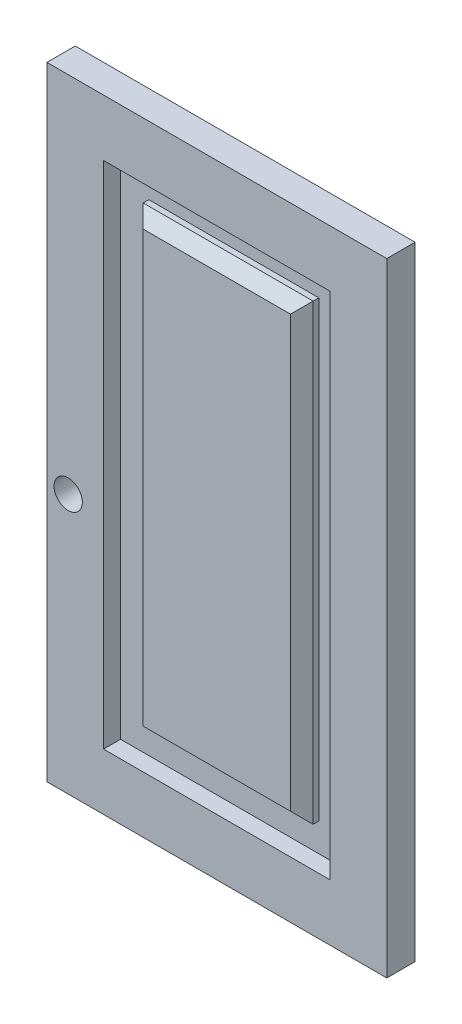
SolidWorks part; units mm, degrees
ref_plane "Front" through (0, 0, 0) normal (0, 0, 1) x (1, 0, 0)
ref_plane "Top" through (0, 0, 0) normal (0, 1, 0) x (1, 0, 0)
ref_plane "Right" through (0, 0, 0) normal (1, 0, 0) x (0, 0, -1)
sketch "Sketch1" plane through (0, 0, 0) normal (0, 0, 1) x (1, 0, 0)
  line L1 (0, 0) -> (60, 0)
  line L2 (0, 0) -> (0, 110)
  line L3 (0, 110) -> (60, 110)
  line L4 (60, 0) -> (60, 110)
extrude "Base-Extrude" add sketch "Sketch1" against normal blind 5
sketch "Sketch2" plane through (-46.244, -4.1497, 0) normal (0, 0, 1) x (1, 0, 0)
  circle A0 centre (50, 50) radius 2.5
  dimension "D1" = 5
extrude "Cut-Extrude1" cut sketch "Sketch2" against normal blind 5
sketch "Sketch3" plane through (0, 0, 0) normal (0, 0, 1) x (1, 0, 0)
  line L0 (15, 95) -> (15, 15)
  line L1 (10, 100) -> (50, 100)
  line L2 (10, 100) -> (10, 10)
  line L3 (10, 10) -> (50, 10)
  line L4 (50, 100) -> (50, 10)
  line L5 (15, 15) -> (45, 15)
  line L6 (45, 95) -> (45, 15)
  line L7 (15, 95) -> (45, 95)
  dimension "D1" = 5
extrude "Cut-Extrude3" cut sketch "Sketch3" against normal blind 3
chamfer "Chamfer1" distance 2 angle 45 4 edges at (30, 95, 0) (45, 55, 0) (30, 15, 0) (15, 55, 0)
